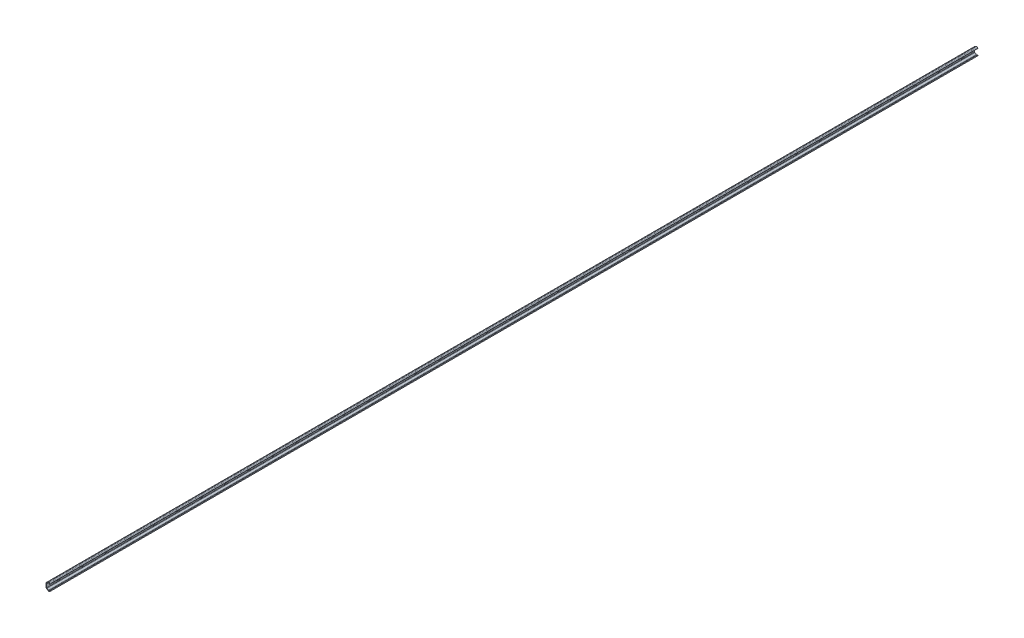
SolidWorks part; units mm, degrees
ref_plane "Front Plane" through (0, 0, 0) normal (0, 0, 1) x (1, 0, 0)
ref_plane "Top Plane" through (0, 0, 0) normal (0, 1, 0) x (1, 0, 0)
ref_plane "Right Plane" through (0, 0, 0) normal (1, 0, 0) x (0, 0, -1)
sketch "Sketch1" plane through (0, 0, 0) normal (0, 0, 1) x (1, 0, 0)
  line L0 (12.7499, 8.8877) -> (14, 11.0528)
  line L1 (14, 11.0528) -> (11.5, 12.4962)
  line L2 (7.4998, 12.4962) -> (1.9999, 9.3207)
  line L3 (0, 5.8567) -> (0, -5.8567)
  line L4 (1.9999, -9.3207) -> (7.4998, -12.4962)
  line L5 (11.5, -12.4962) -> (14, -11.0528)
  line L6 (14, -11.0528) -> (12.7499, -8.8877)
  line L7 (12.7499, -8.8877) -> (10.4999, -10.1867)
  line L8 (8.4998, -10.1867) -> (3.5001, -7.3)
  line L10 (2.5002, -5.568) -> (2.5002, 0)
  line L11 (2.5002, 0) -> (2.5002, 5.568)
  line L12 (3.5001, 7.3) -> (8.4998, 10.1867)
  line L13 (10.4999, 10.1867) -> (12.7499, 8.8877)
  arc A0 (11.5, 12.4962) -> (7.4998, 12.4962) centre (9.4999, 9.032) ccw
  arc A1 (1.9999, 9.3207) -> (0, 5.8567) centre (4, 5.8567) ccw
  arc A2 (0, -5.8567) -> (1.9999, -9.3207) centre (4, -5.8567) ccw
  arc A3 (7.4998, -12.4962) -> (11.5, -12.4962) centre (9.4999, -9.032) ccw
  arc A4 (10.4999, -10.1867) -> (8.4998, -10.1867) centre (9.4999, -8.4547) cw
  arc A6 (2.5002, 5.568) -> (3.5001, 7.3) centre (4.5002, 5.568) cw
  arc A7 (8.4998, 10.1867) -> (10.4999, 10.1867) centre (9.4999, 8.4547) cw
  arc A8 (2.5002, -5.568) -> (3.5001, -7.3) centre (4.5002, -5.568) ccw
  point P50 (0, 0)
  dimension "D1" = 4.0001
  dimension "D2" = 4
  dimension "D3" = 1.9999
  dimension "D4" = 2
  dimension "D5" = 2.5002
  dimension "D6" = 7.4998
  dimension "D7" = 12.7499
  dimension "D8" = 14
  dimension "D9" = 5.568
extrude "Boss-Extrude1" add sketch "Sketch1" against normal blind 3120 contours L11 A6 L12 A7 L13 L0 L1 A0 L2 A1 L3 A2 L4 A3 L5 L6 L7 A4 L8 A8 L10
sketch "Sketch2" plane through (2.5002, 0, 0) normal (1, 0, 0) x (0, 0, -1)
  line L0 (37.5, 0) -> (42.5, 0) construction
  line L1 (37.5, 3) -> (42.5, 3)
  line L2 (37.5, -3) -> (42.5, -3)
  arc A0 (37.5, 3) -> (37.5, -3) centre (37.5, 0) ccw
  arc A1 (42.5, -3) -> (42.5, 3) centre (42.5, 0) ccw
  point P2 (40, 0)
  point P9 (40, 3)
  dimension "D1" = 5
  dimension "D2" = 6
  dimension "D3" = 40
extrude "Cut-Extrude1" cut sketch "Sketch2" against normal through all
pattern_linear "LPattern1" count 39 spacing 80 along (0, 0, -1) of "Cut-Extrude1"
